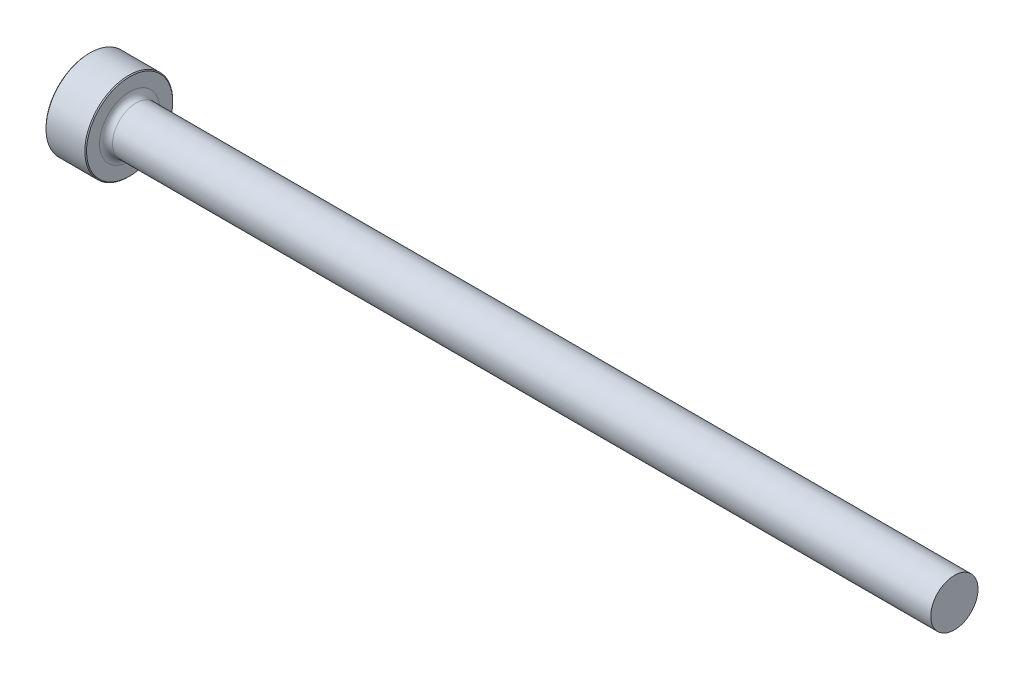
SolidWorks part; units mm, degrees
ref_plane "Front Plane" through (0, 0, 0) normal (0, 0, 1) x (1, 0, 0)
ref_plane "Top Plane" through (0, 0, 0) normal (0, 1, 0) x (1, 0, 0)
ref_plane "Right Plane" through (0, 0, 0) normal (1, 0, 0) x (0, 0, -1)
sketch "Sketch1" plane through (0, 0, 0) normal (0, 0, 1) x (1, 0, 0)
  line L0 (0, 0) -> (0, 5.1594)
  line L1 (0, 5.1594) -> (4.7625, 5.1594)
  line L2 (4.7625, 5.1594) -> (4.7625, 3.5363)
  line L3 (5.5245, 2.7743) -> (101.6, 2.7743)
  line L4 (101.6, 2.7743) -> (101.6, 0)
  line L5 (101.6, 0) -> (0, 0)
  line L6 (101.6, 0) -> (101.6, -2.7743) construction
  line L7 (101.6, -2.7743) -> (4.7625, -2.7743) construction
  line L8 (0, 0) -> (0, -5.1594) construction
  line L9 (0, -5.1594) -> (4.7625, -5.1594) construction
  line L10 (4.7625, -5.1594) -> (4.7625, -2.7743) construction
  arc A0 (4.7625, 3.5363) -> (5.5245, 2.7743) centre (5.5245, 3.5363) ccw
  dimension "D4" = 0.762
  dimension "L" = 101.6
  dimension "D" = 5.5486
  dimension "H" = 10.3187
  dimension "T" = 4.7625
revolve "Revolve1" add sketch "Sketch1" angle 360 about L5
chamfer "Chamfer1" distance 0.1016 angle 45 2 edges at (0, 5.1594, 0) (4.7625, 5.1594, 0)
